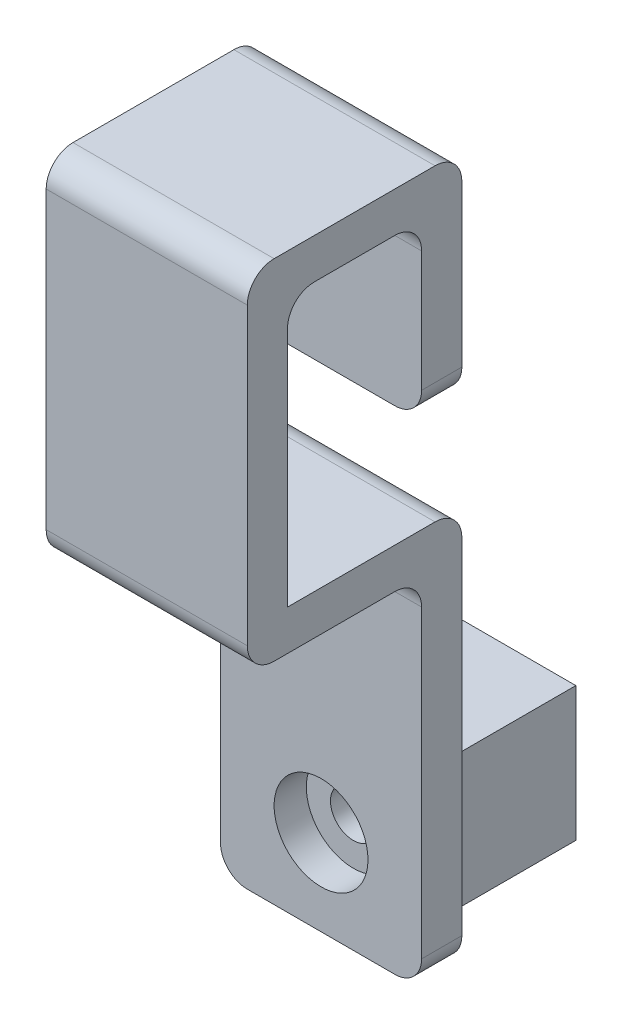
SolidWorks part; units mm, degrees
ref_plane "Płaszczyzna przednia" through (0, 0, 0) normal (0, 0, 1) x (1, 0, 0)
ref_plane "Płaszczyzna górna" through (0, 0, 0) normal (0, 1, 0) x (1, 0, 0)
ref_plane "Płaszczyzna prawa" through (0, 0, 0) normal (1, 0, 0) x (0, 0, -1)
sketch "Szkic1" plane through (0, 0, 0) normal (0, 0, 1) x (1, 0, 0)
  line L1 (-5, 5) -> (5, 5)
  line L2 (-5, 5) -> (-5, -5)
  line L3 (-5, -5) -> (5, -5)
  line L4 (5, 5) -> (5, -5)
  line L5 (-5, 5) -> (5, -5) construction
  line L6 (-5, -5) -> (5, 5) construction
  point P0 (0, 0)
  dimension "D1" = 10
  dimension "D2" = 10
extrude "Dodanie-wyciągnięcie1" add sketch "Szkic1" along normal blind 11
sketch "Szkic2" plane through (0, 0, 11) normal (0, 0, 1) x (1, 0, 0)
  line L0 (-5, -5) -> (5, -5) construction
  line L1 (-7.5, -6.4012) -> (7.5, -6.4012)
  line L2 (-7.5, -6.4012) -> (-7.5, 23.3205)
  line L3 (-7.5, 23.3205) -> (7.5, 23.3205)
  line L4 (7.5, -6.4012) -> (7.5, 23.3205)
  line L5 (-7.5, -6.4012) -> (7.5, 23.3205) construction
  line L6 (-7.5, 23.3205) -> (7.5, -6.4012) construction
  point P4 (0, 8.4597)
  point P5 (0, -5)
  point P10 (-10.861, 2.1623)
  dimension "D1" = 15
  dimension "D2" = 29.7217
  dimension "D3" = 0
extrude "Dodanie-wyciągnięcie2" add sketch "Szkic2" along normal blind 3
sketch "Szkic3" plane through (0, 0, 14) normal (0, 0, 1) x (1, 0, 0)
  line L0 (7.5, -6.4012) -> (7.5, 23.3205) construction
  line L1 (-7.5, 23.3205) -> (7.5, 23.3205)
  line L2 (-7.5, 23.3205) -> (-7.5, 20.3205)
  line L3 (-7.5, 20.3205) -> (7.5, 20.3205)
  line L4 (7.5, 23.3205) -> (7.5, 20.3205)
  line L5 (-7.5, 23.3205) -> (7.5, 20.3205) construction
  line L6 (-7.5, 20.3205) -> (7.5, 23.3205) construction
  point P4 (0, 21.8205)
  dimension "D1" = 3
extrude "Dodanie-wyciągnięcie3" add sketch "Szkic3" along normal blind 13
sketch "Szkic4" plane through (0, 0, 14) normal (0, 0, 1) x (1, 0, 0)
  point P0 (0, 0)
hole_wizard "Pogłębienie walcowe pod M3 Śrubę z łbem stożkowym ściętym1" positions "Szkic 3D1" profile "Szkic5" counterbore size "M3" standard "ISO"
sketch3d "Szkic 3D1"
  point P0 (0, 0, 14)
sketch "Szkic5" plane through (0, 0, 14) normal (1, 0, 0) x (0, -1, 0)
  line L0 (0, 0) -> (0, 14)
  line L1 (0, 14) -> (1.7, 14)
  line L3 (1.7, 14) -> (1.7, 2.4)
  line L4 (1.7, 2.4) -> (3.5, 2.4)
  line L5 (3.5, 2.4) -> (3.5, 0)
  line L7 (3.5, 0) -> (0, 0)
  line L11 (0, -6.35) -> (0, 107.95) construction
  dimension "Średnica otworu na wylot" = 3.4
  dimension "Głębokość otworu na wylot" = 14
  dimension "Średnica pogłębienia walcowego" = 7
  dimension "Głębokość pogłębienia walcowego" = 2.4
fillet "Zaokrąglenie1" radius 2 2 edges at (-7.5, -6.4012, 12.5) (7.5, -6.4012, 12.5)
fillet "Zaokrąglenie2" radius 2 2 edges at (0, 23.3205, 11)
sketch "Szkic6" plane through (0, 23.3205, 0) normal (0, 1, 0) x (1, 0, 0)
  line L0 (-7.5, -27) -> (-7.5, -13) construction
  line L1 (7.5, -27) -> (-7.5, -27)
  line L2 (7.5, -27) -> (7.5, -24)
  line L3 (7.5, -24) -> (-7.5, -24)
  line L4 (-7.5, -27) -> (-7.5, -24)
  line L5 (7.5, -27) -> (-7.5, -24) construction
  line L6 (7.5, -24) -> (-7.5, -27) construction
  point P4 (0, -25.5)
  dimension "D1" = 3
extrude "Dodanie-wyciągnięcie4" add sketch "Szkic6" along normal blind 23
sketch "Szkic7" plane through (0, 0, 24) normal (0, 0, -1) x (-1, 0, 0)
  line L0 (7.5, 46.3205) -> (7.5, 23.3205) construction
  line L1 (-7.5, 46.3205) -> (7.5, 46.3205)
  line L2 (-7.5, 46.3205) -> (-7.5, 43.3205)
  line L3 (-7.5, 43.3205) -> (7.5, 43.3205)
  line L4 (7.5, 46.3205) -> (7.5, 43.3205)
  line L5 (-7.5, 46.3205) -> (7.5, 43.3205) construction
  line L6 (-7.5, 43.3205) -> (7.5, 46.3205) construction
  point P4 (0, 44.8205)
  dimension "D1" = 3
extrude "Dodanie-wyciągnięcie5" add sketch "Szkic7" along normal blind 13
sketch "Szkic8" plane through (0, 43.3205, 0) normal (0, -1, 0) x (1, 0, 0)
  line L0 (-7.5, 11) -> (-7.5, 24) construction
  line L1 (7.5, 11) -> (-7.5, 11)
  line L2 (7.5, 11) -> (7.5, 14)
  line L3 (7.5, 14) -> (-7.5, 14)
  line L4 (-7.5, 11) -> (-7.5, 14)
  line L5 (7.5, 11) -> (-7.5, 14) construction
  line L6 (7.5, 14) -> (-7.5, 11) construction
  point P4 (0, 12.5)
  dimension "D1" = 3
extrude "Dodanie-wyciągnięcie6" add sketch "Szkic8" along normal blind 13
fillet "Zaokrąglenie3" radius 2 5 edges at (0, 46.3205, 11) (0, 46.3205, 27) (0, 20.3205, 27) (0, 43.3205, 24) (0, 43.3205, 14)
fillet "Zaokrąglenie4" radius 2 2 edges at (7.5, 30.3205, 12.5) (-7.5, 30.3205, 12.5)
